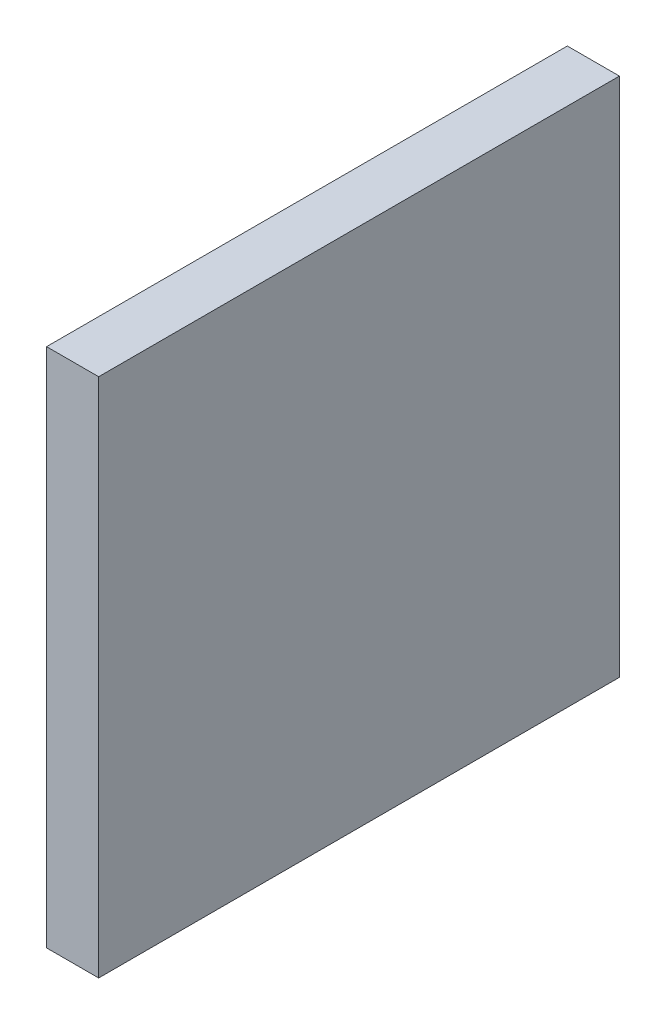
SolidWorks part; units mm, degrees
ref_plane "Front Plane" through (0, 0, 0) normal (0, 0, 1) x (1, 0, 0)
ref_plane "Top Plane" through (0, 0, 0) normal (0, 1, 0) x (1, 0, 0)
ref_plane "Right Plane" through (0, 0, 0) normal (1, 0, 0) x (0, 0, -1)
sketch "Sketch1" plane through (0, 0, 0) normal (1, 0, 0) x (0, 0, -1)
  line L1 (0, 0) -> (25.4, 0)
  line L2 (0, 0) -> (0, 25.4)
  line L3 (0, 25.4) -> (25.4, 25.4)
  line L4 (25.4, 0) -> (25.4, 25.4)
  point P4 (0, 0)
  point P5 (0, 0)
  dimension "D1" = 25.4
  dimension "D2" = 25.4
extrude "Boss-Extrude1" add sketch "Sketch1" along normal blind 2.54
